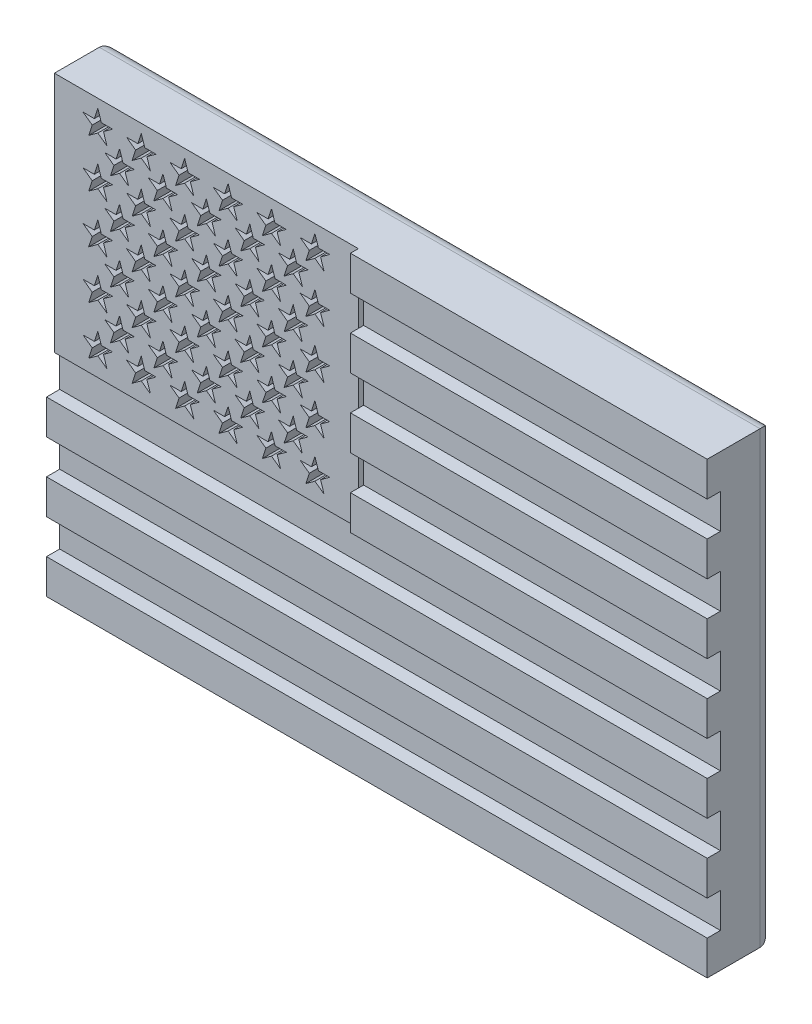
SolidWorks part; units mm, degrees
ref_plane "Front Plane" through (0, 0, 0) normal (0, 0, 1) x (1, 0, 0)
ref_plane "Top Plane" through (0, 0, 0) normal (0, 1, 0) x (1, 0, 0)
ref_plane "Right Plane" through (0, 0, 0) normal (1, 0, 0) x (0, 0, -1)
sketch "Sketch1" plane through (0, 0, 0) normal (0, 0, 1) x (1, 0, 0)
  line L1 (-15.875, -10.795) -> (15.875, -10.795)
  line L2 (-15.875, -10.795) -> (-15.875, 10.795)
  line L3 (-15.875, 10.795) -> (15.875, 10.795)
  line L4 (15.875, -10.795) -> (15.875, 10.795)
  line L5 (-15.875, -10.795) -> (15.875, 10.795) construction
  line L6 (-15.875, 10.795) -> (15.875, -10.795) construction
  point P0 (0, 0)
  dimension "D1" = 31.75
  dimension "D2" = 21.59
extrude "Boss-Extrude1" add sketch "Sketch1" along normal blind 2.54
fillet "Fillet1" radius 0.635 4 edges at (-15.875, 0, 0) (0, -10.795, 0) (0, 10.795, 0) (15.875, 0, 0)
sketch "Sketch2" plane through (0, 0, 2.54) normal (0, 0, 1) x (1, 0, 0)
  line L0 (15.875, 10.795) -> (15.875, 9.1342)
  line L1 (15.875, -10.795) -> (15.875, 10.795) construction
  line L2 (15.875, 9.1342) -> (15.875, 7.4735) construction
  line L3 (15.875, 7.4735) -> (15.875, 5.8127)
  line L4 (15.875, 5.8127) -> (15.875, 4.1519) construction
  line L5 (15.875, 4.1519) -> (15.875, 2.4912)
  line L6 (15.875, 2.4912) -> (15.875, 0.8304) construction
  line L7 (15.875, 0.8304) -> (15.875, -0.8304)
  line L10 (15.875, -0.8304) -> (15.875, -2.4912) construction
  line L11 (15.875, -2.4912) -> (15.875, -4.1519)
  line L12 (15.875, -4.1519) -> (15.875, -5.8127) construction
  line L13 (15.875, -5.8127) -> (15.875, -7.4735)
  line L14 (15.875, -7.4735) -> (15.875, -9.1342) construction
  line L15 (15.875, -9.1342) -> (15.875, -10.795)
  line L16 (-15.875, -10.795) -> (15.875, -10.795) construction
  line L17 (15.875, 4.1519) -> (-1.27, 4.1519)
  line L18 (15.875, 10.795) -> (-15.875, 10.795) construction
  line L19 (-1.27, 4.1519) -> (-1.27, 2.4912)
  line L21 (15.875, 9.1342) -> (-1.27, 9.1342)
  line L22 (-1.27, 10.795) -> (15.875, 10.795)
  line L23 (15.875, 7.4735) -> (-1.27, 7.4735)
  line L24 (15.875, 5.8127) -> (-1.27, 5.8127)
  line L25 (-1.27, 2.4912) -> (15.875, 2.4912)
  line L26 (-1.27, 5.8127) -> (-1.27, 7.4735)
  line L27 (-1.27, 9.1342) -> (-1.27, 10.795)
  line L28 (15.875, 0.8304) -> (-1.27, 0.8304)
  line L29 (-1.27, 0.8304) -> (-1.27, -0.8304)
  line L30 (-1.27, -0.8304) -> (15.875, -0.8304)
  line L31 (15.875, -2.4912) -> (-15.875, -2.4912)
  line L32 (-15.875, -2.4912) -> (-15.875, -4.1519)
  line L33 (-15.875, -4.1519) -> (15.875, -4.1519)
  line L34 (15.875, -5.8127) -> (-15.875, -5.8127)
  line L35 (-15.875, -5.8127) -> (-15.875, -7.4735)
  line L36 (-15.875, -7.4735) -> (15.875, -7.4735)
  line L37 (15.875, -9.1342) -> (-15.875, -9.1342)
  line L38 (-15.875, -9.1342) -> (-15.875, -10.795)
  line L39 (-15.875, -10.795) -> (15.875, -10.795)
  line L40 (-15.875, 10.795) -> (-15.875, -10.795) construction
  line L41 (-1.27, -0.8304) -> (-15.875, -0.8304) construction
  point P5 (-2.2743, -0.8304)
  point P43 (0, 0)
  dimension "D1" = 14.605
extrude "Boss-Extrude2" add sketch "Sketch2" along normal blind 0.635
sketch "Sketch3" plane through (0, 0, 2.54) normal (0, 0, 1) x (1, 0, 0)
  line L1 (-1.27, -0.8304) -> (-15.875, -0.8304)
  line L2 (-1.27, -0.8304) -> (-1.27, 10.795)
  line L3 (-1.27, 10.795) -> (-15.875, 10.795)
  line L4 (-15.875, -0.8304) -> (-15.875, 10.795)
extrude "Boss-Extrude3" add sketch "Sketch3" along normal blind 0.635
sketch "Sketch4" plane through (0, 0, 3.175) normal (0, 0, 1) x (1, 0, 0)
  line L0 (-15.875, 10.795) -> (-15.875, 8.4699) construction
  line L1 (-15.875, 10.795) -> (-15.875, -0.8304) construction
  line L2 (-15.875, 8.4699) -> (-15.875, 6.1448) construction
  line L3 (-15.875, 6.1448) -> (-15.875, 3.8198) construction
  line L4 (-15.875, 3.8198) -> (-15.875, 1.4947) construction
  line L5 (-15.875, 1.4947) -> (-15.875, -0.8304) construction
  line L6 (-15.875, 9.6325) -> (-13.7886, 9.6325) construction
  line L7 (-13.7886, 9.6325) -> (-11.7021, 9.6325) construction
  line L8 (-11.7021, 9.6325) -> (-9.6157, 9.6325) construction
  line L9 (-9.6157, 9.6325) -> (-7.5293, 9.6325) construction
  line L10 (-7.5293, 9.6325) -> (-5.4429, 9.6325) construction
  line L11 (-5.4429, 9.6325) -> (-3.3564, 9.6325) construction
  line L12 (-3.3564, 9.6325) -> (-1.27, 9.6325) construction
  line L13 (-13.7886, 10.3781) -> (-14.4977, 9.8629) construction
  line L14 (-14.4977, 9.8629) -> (-14.2269, 9.0292) construction
  line L15 (-14.2269, 9.0292) -> (-13.3503, 9.0292) construction
  line L16 (-13.3503, 9.0292) -> (-13.0794, 9.8629) construction
  line L17 (-13.0794, 9.8629) -> (-13.7886, 10.3781) construction
  line L18 (-13.7886, 10.3781) -> (-13.956, 9.8629)
  line L19 (-13.956, 9.8629) -> (-14.4977, 9.8629)
  line L20 (-14.4977, 9.8629) -> (-14.0594, 9.5444)
  line L21 (-14.0594, 9.5444) -> (-14.2269, 9.0292)
  line L22 (-14.2269, 9.0292) -> (-13.7886, 9.3476)
  line L23 (-13.7886, 9.3476) -> (-13.3503, 9.0292)
  line L24 (-13.3503, 9.0292) -> (-13.5177, 9.5444)
  line L25 (-13.5177, 9.5444) -> (-13.0794, 9.8629)
  line L26 (-13.0794, 9.8629) -> (-13.6212, 9.8629)
  line L27 (-13.6212, 9.8629) -> (-13.7886, 10.3781)
  line L28 (-14.0594, 9.5444) -> (-13.7886, 9.6325) construction
  line L29 (-13.7886, 9.6325) -> (-13.7886, 9.3476) construction
  line L30 (-13.5177, 9.5444) -> (-13.7886, 9.6325) construction
  line L31 (-13.7886, 9.6325) -> (-13.6212, 9.8629) construction
  line L32 (-13.956, 9.8629) -> (-13.7886, 9.6325) construction
  line L33 (-11.5347, 9.8629) -> (-11.7021, 10.3781)
  line L34 (-11.7021, 10.3781) -> (-11.8696, 9.8629)
  line L35 (-11.8696, 9.8629) -> (-12.4113, 9.8629)
  line L36 (-12.4113, 9.8629) -> (-11.973, 9.5444)
  line L37 (-11.973, 9.5444) -> (-12.1404, 9.0292)
  line L38 (-12.1404, 9.0292) -> (-11.7021, 9.3476)
  line L39 (-11.7021, 9.3476) -> (-11.2639, 9.0292)
  line L40 (-11.2639, 9.0292) -> (-11.4313, 9.5444)
  line L41 (-11.4313, 9.5444) -> (-10.993, 9.8629)
  line L42 (-10.993, 9.8629) -> (-11.5347, 9.8629)
  line L43 (-9.4483, 9.8629) -> (-9.6157, 10.3781)
  line L44 (-9.6157, 10.3781) -> (-9.7831, 9.8629)
  line L45 (-9.7831, 9.8629) -> (-10.3249, 9.8629)
  line L46 (-10.3249, 9.8629) -> (-9.8866, 9.5444)
  line L47 (-9.8866, 9.5444) -> (-10.054, 9.0292)
  line L48 (-10.054, 9.0292) -> (-9.6157, 9.3476)
  line L49 (-9.6157, 9.3476) -> (-9.1774, 9.0292)
  line L50 (-9.1774, 9.0292) -> (-9.3448, 9.5444)
  line L51 (-9.3448, 9.5444) -> (-8.9066, 9.8629)
  line L52 (-8.9066, 9.8629) -> (-9.4483, 9.8629)
  line L53 (-7.3619, 9.8629) -> (-7.5293, 10.3781)
  line L54 (-7.5293, 10.3781) -> (-7.6967, 9.8629)
  line L55 (-7.6967, 9.8629) -> (-8.2384, 9.8629)
  line L56 (-8.2384, 9.8629) -> (-7.8002, 9.5444)
  line L57 (-7.8002, 9.5444) -> (-7.9676, 9.0292)
  line L58 (-7.9676, 9.0292) -> (-7.5293, 9.3476)
  line L59 (-7.5293, 9.3476) -> (-7.091, 9.0292)
  line L60 (-7.091, 9.0292) -> (-7.2584, 9.5444)
  line L61 (-7.2584, 9.5444) -> (-6.8201, 9.8629)
  line L62 (-6.8201, 9.8629) -> (-7.3619, 9.8629)
  line L63 (-5.2754, 9.8629) -> (-5.4429, 10.3781)
  line L64 (-5.4429, 10.3781) -> (-5.6103, 9.8629)
  line L65 (-5.6103, 9.8629) -> (-6.152, 9.8629)
  line L66 (-6.152, 9.8629) -> (-5.7137, 9.5444)
  line L67 (-5.7137, 9.5444) -> (-5.8811, 9.0292)
  line L68 (-5.8811, 9.0292) -> (-5.4429, 9.3476)
  line L69 (-5.4429, 9.3476) -> (-5.0046, 9.0292)
  line L70 (-5.0046, 9.0292) -> (-5.172, 9.5444)
  line L71 (-5.172, 9.5444) -> (-4.7337, 9.8629)
  line L72 (-4.7337, 9.8629) -> (-5.2754, 9.8629)
  line L73 (-3.189, 9.8629) -> (-3.3564, 10.3781)
  line L74 (-3.3564, 10.3781) -> (-3.5238, 9.8629)
  line L75 (-3.5238, 9.8629) -> (-4.0656, 9.8629)
  line L76 (-4.0656, 9.8629) -> (-3.6273, 9.5444)
  line L77 (-3.6273, 9.5444) -> (-3.7947, 9.0292)
  line L78 (-3.7947, 9.0292) -> (-3.3564, 9.3476)
  line L79 (-3.3564, 9.3476) -> (-2.9181, 9.0292)
  line L80 (-2.9181, 9.0292) -> (-3.0856, 9.5444)
  line L81 (-3.0856, 9.5444) -> (-2.6473, 9.8629)
  line L82 (-2.6473, 9.8629) -> (-3.189, 9.8629)
  line L83 (-3.5238, 9.8629) -> (-3.189, 9.8629) construction
  line L84 (-15.875, 7.3074) -> (-13.7886, 7.3074) construction
  line L85 (-13.6212, 7.5446) -> (-13.7886, 8.0598)
  line L86 (-13.7886, 8.0598) -> (-13.956, 7.5446)
  line L87 (-13.956, 7.5446) -> (-14.4977, 7.5446)
  line L88 (-14.4977, 7.5446) -> (-14.0594, 7.2262)
  line L89 (-14.0594, 7.2262) -> (-14.2269, 6.7109)
  line L90 (-14.2269, 6.7109) -> (-13.7886, 7.0294)
  line L91 (-13.7886, 7.0294) -> (-13.3503, 6.7109)
  line L92 (-13.3503, 6.7109) -> (-13.5177, 7.2262)
  line L93 (-13.5177, 7.2262) -> (-13.0794, 7.5446)
  line L94 (-13.0794, 7.5446) -> (-13.6212, 7.5446)
  line L95 (-11.5347, 7.5446) -> (-11.7021, 8.0598)
  line L96 (-11.7021, 8.0598) -> (-11.8696, 7.5446)
  line L97 (-11.8696, 7.5446) -> (-12.4113, 7.5446)
  line L98 (-12.4113, 7.5446) -> (-11.973, 7.2262)
  line L99 (-11.973, 7.2262) -> (-12.1404, 6.7109)
  line L100 (-12.1404, 6.7109) -> (-11.7021, 7.0294)
  line L101 (-11.7021, 7.0294) -> (-11.2639, 6.7109)
  line L102 (-11.2639, 6.7109) -> (-11.4313, 7.2262)
  line L103 (-11.4313, 7.2262) -> (-10.993, 7.5446)
  line L104 (-10.993, 7.5446) -> (-11.5347, 7.5446)
  line L105 (-9.4483, 7.5446) -> (-9.6157, 8.0598)
  line L106 (-9.6157, 8.0598) -> (-9.7831, 7.5446)
  line L107 (-9.7831, 7.5446) -> (-10.3249, 7.5446)
  line L108 (-10.3249, 7.5446) -> (-9.8866, 7.2262)
  line L109 (-9.8866, 7.2262) -> (-10.054, 6.7109)
  line L110 (-10.054, 6.7109) -> (-9.6157, 7.0294)
  line L111 (-9.6157, 7.0294) -> (-9.1774, 6.7109)
  line L112 (-9.1774, 6.7109) -> (-9.3448, 7.2262)
  line L113 (-9.3448, 7.2262) -> (-8.9066, 7.5446)
  line L114 (-8.9066, 7.5446) -> (-9.4483, 7.5446)
  line L115 (-7.3619, 7.5446) -> (-7.5293, 8.0598)
  line L116 (-7.5293, 8.0598) -> (-7.6967, 7.5446)
  line L117 (-7.6967, 7.5446) -> (-8.2384, 7.5446)
  line L118 (-8.2384, 7.5446) -> (-7.8002, 7.2262)
  line L119 (-7.8002, 7.2262) -> (-7.9676, 6.7109)
  line L120 (-7.9676, 6.7109) -> (-7.5293, 7.0294)
  line L121 (-7.5293, 7.0294) -> (-7.091, 6.7109)
  line L122 (-7.091, 6.7109) -> (-7.2584, 7.2262)
  line L123 (-7.2584, 7.2262) -> (-6.8201, 7.5446)
  line L124 (-6.8201, 7.5446) -> (-7.3619, 7.5446)
  line L125 (-5.2754, 7.5446) -> (-5.4429, 8.0598)
  line L126 (-5.4429, 8.0598) -> (-5.6103, 7.5446)
  line L127 (-5.6103, 7.5446) -> (-6.152, 7.5446)
  line L128 (-6.152, 7.5446) -> (-5.7137, 7.2262)
  line L129 (-5.7137, 7.2262) -> (-5.8811, 6.7109)
  line L130 (-5.8811, 6.7109) -> (-5.4429, 7.0294)
  line L131 (-5.4429, 7.0294) -> (-5.0046, 6.7109)
  line L132 (-5.0046, 6.7109) -> (-5.172, 7.2262)
  line L133 (-5.172, 7.2262) -> (-4.7337, 7.5446)
  line L134 (-4.7337, 7.5446) -> (-5.2754, 7.5446)
  line L135 (-3.189, 7.5446) -> (-3.3564, 8.0598)
  line L136 (-3.3564, 8.0598) -> (-3.5238, 7.5446)
  line L137 (-3.5238, 7.5446) -> (-4.0656, 7.5446)
  line L138 (-4.0656, 7.5446) -> (-3.6273, 7.2262)
  line L139 (-3.6273, 7.2262) -> (-3.7947, 6.7109)
  line L140 (-3.7947, 6.7109) -> (-3.3564, 7.0294)
  line L141 (-3.3564, 7.0294) -> (-2.9181, 6.7109)
  line L142 (-2.9181, 6.7109) -> (-3.0856, 7.2262)
  line L143 (-3.0856, 7.2262) -> (-2.6473, 7.5446)
  line L144 (-2.6473, 7.5446) -> (-3.189, 7.5446)
  line L145 (-13.6212, 5.2263) -> (-13.7886, 5.7416)
  line L146 (-13.7886, 5.7416) -> (-13.956, 5.2263)
  line L147 (-13.956, 5.2263) -> (-14.4977, 5.2263)
  line L148 (-14.4977, 5.2263) -> (-14.0594, 4.9079)
  line L149 (-14.0594, 4.9079) -> (-14.2269, 4.3927)
  line L150 (-14.2269, 4.3927) -> (-13.7886, 4.7111)
  line L151 (-13.7886, 4.7111) -> (-13.3503, 4.3927)
  line L152 (-13.3503, 4.3927) -> (-13.5177, 4.9079)
  line L153 (-13.5177, 4.9079) -> (-13.0794, 5.2263)
  line L154 (-13.0794, 5.2263) -> (-13.6212, 5.2263)
  line L155 (-11.5347, 5.2263) -> (-11.7021, 5.7416)
  line L156 (-11.7021, 5.7416) -> (-11.8696, 5.2263)
  line L157 (-11.8696, 5.2263) -> (-12.4113, 5.2263)
  line L158 (-12.4113, 5.2263) -> (-11.973, 4.9079)
  line L159 (-11.973, 4.9079) -> (-12.1404, 4.3927)
  line L160 (-12.1404, 4.3927) -> (-11.7021, 4.7111)
  line L161 (-11.7021, 4.7111) -> (-11.2639, 4.3927)
  line L162 (-11.2639, 4.3927) -> (-11.4313, 4.9079)
  line L163 (-11.4313, 4.9079) -> (-10.993, 5.2263)
  line L164 (-10.993, 5.2263) -> (-11.5347, 5.2263)
  line L165 (-9.4483, 5.2263) -> (-9.6157, 5.7416)
  line L166 (-9.6157, 5.7416) -> (-9.7831, 5.2263)
  line L167 (-9.7831, 5.2263) -> (-10.3249, 5.2263)
  line L168 (-10.3249, 5.2263) -> (-9.8866, 4.9079)
  line L169 (-9.8866, 4.9079) -> (-10.054, 4.3927)
  line L170 (-10.054, 4.3927) -> (-9.6157, 4.7111)
  line L171 (-9.6157, 4.7111) -> (-9.1774, 4.3927)
  line L172 (-9.1774, 4.3927) -> (-9.3448, 4.9079)
  line L173 (-9.3448, 4.9079) -> (-8.9066, 5.2263)
  line L174 (-8.9066, 5.2263) -> (-9.4483, 5.2263)
  line L175 (-7.3619, 5.2263) -> (-7.5293, 5.7416)
  line L176 (-7.5293, 5.7416) -> (-7.6967, 5.2263)
  line L177 (-7.6967, 5.2263) -> (-8.2384, 5.2263)
  line L178 (-8.2384, 5.2263) -> (-7.8002, 4.9079)
  line L179 (-7.8002, 4.9079) -> (-7.9676, 4.3927)
  line L180 (-7.9676, 4.3927) -> (-7.5293, 4.7111)
  line L181 (-7.5293, 4.7111) -> (-7.091, 4.3927)
  line L182 (-7.091, 4.3927) -> (-7.2584, 4.9079)
  line L183 (-7.2584, 4.9079) -> (-6.8201, 5.2263)
  line L184 (-6.8201, 5.2263) -> (-7.3619, 5.2263)
  line L185 (-5.2754, 5.2263) -> (-5.4429, 5.7416)
  line L186 (-5.4429, 5.7416) -> (-5.6103, 5.2263)
  line L187 (-5.6103, 5.2263) -> (-6.152, 5.2263)
  line L188 (-6.152, 5.2263) -> (-5.7137, 4.9079)
  line L189 (-5.7137, 4.9079) -> (-5.8811, 4.3927)
  line L190 (-5.8811, 4.3927) -> (-5.4429, 4.7111)
  line L191 (-5.4429, 4.7111) -> (-5.0046, 4.3927)
  line L192 (-5.0046, 4.3927) -> (-5.172, 4.9079)
  line L193 (-5.172, 4.9079) -> (-4.7337, 5.2263)
  line L194 (-4.7337, 5.2263) -> (-5.2754, 5.2263)
  line L195 (-3.189, 5.2263) -> (-3.3564, 5.7416)
  line L196 (-3.3564, 5.7416) -> (-3.5238, 5.2263)
  line L197 (-3.5238, 5.2263) -> (-4.0656, 5.2263)
  line L198 (-4.0656, 5.2263) -> (-3.6273, 4.9079)
  line L199 (-3.6273, 4.9079) -> (-3.7947, 4.3927)
  line L200 (-3.7947, 4.3927) -> (-3.3564, 4.7111)
  line L201 (-3.3564, 4.7111) -> (-2.9181, 4.3927)
  line L202 (-2.9181, 4.3927) -> (-3.0856, 4.9079)
  line L203 (-3.0856, 4.9079) -> (-2.6473, 5.2263)
  line L204 (-2.6473, 5.2263) -> (-3.189, 5.2263)
  line L205 (-13.6212, 2.908) -> (-13.7886, 3.4233)
  line L206 (-13.7886, 3.4233) -> (-13.956, 2.908)
  line L207 (-13.956, 2.908) -> (-14.4977, 2.908)
  line L208 (-14.4977, 2.908) -> (-14.0594, 2.5896)
  line L209 (-14.0594, 2.5896) -> (-14.2269, 2.0744)
  line L210 (-14.2269, 2.0744) -> (-13.7886, 2.3928)
  line L211 (-13.7886, 2.3928) -> (-13.3503, 2.0744)
  line L212 (-13.3503, 2.0744) -> (-13.5177, 2.5896)
  line L213 (-13.5177, 2.5896) -> (-13.0794, 2.908)
  line L214 (-13.0794, 2.908) -> (-13.6212, 2.908)
  line L215 (-11.5347, 2.908) -> (-11.7021, 3.4233)
  line L216 (-11.7021, 3.4233) -> (-11.8696, 2.908)
  line L217 (-11.8696, 2.908) -> (-12.4113, 2.908)
  line L218 (-12.4113, 2.908) -> (-11.973, 2.5896)
  line L219 (-11.973, 2.5896) -> (-12.1404, 2.0744)
  line L220 (-12.1404, 2.0744) -> (-11.7021, 2.3928)
  line L221 (-11.7021, 2.3928) -> (-11.2639, 2.0744)
  line L222 (-11.2639, 2.0744) -> (-11.4313, 2.5896)
  line L223 (-11.4313, 2.5896) -> (-10.993, 2.908)
  line L224 (-10.993, 2.908) -> (-11.5347, 2.908)
  line L225 (-9.4483, 2.908) -> (-9.6157, 3.4233)
  line L226 (-9.6157, 3.4233) -> (-9.7831, 2.908)
  line L227 (-9.7831, 2.908) -> (-10.3249, 2.908)
  line L228 (-10.3249, 2.908) -> (-9.8866, 2.5896)
  line L229 (-9.8866, 2.5896) -> (-10.054, 2.0744)
  line L230 (-10.054, 2.0744) -> (-9.6157, 2.3928)
  line L231 (-9.6157, 2.3928) -> (-9.1774, 2.0744)
  line L232 (-9.1774, 2.0744) -> (-9.3448, 2.5896)
  line L233 (-9.3448, 2.5896) -> (-8.9066, 2.908)
  line L234 (-8.9066, 2.908) -> (-9.4483, 2.908)
  line L235 (-7.3619, 2.908) -> (-7.5293, 3.4233)
  line L236 (-7.5293, 3.4233) -> (-7.6967, 2.908)
  line L237 (-7.6967, 2.908) -> (-8.2384, 2.908)
  line L238 (-8.2384, 2.908) -> (-7.8002, 2.5896)
  line L239 (-7.8002, 2.5896) -> (-7.9676, 2.0744)
  line L240 (-7.9676, 2.0744) -> (-7.5293, 2.3928)
  line L241 (-7.5293, 2.3928) -> (-7.091, 2.0744)
  line L242 (-7.091, 2.0744) -> (-7.2584, 2.5896)
  line L243 (-7.2584, 2.5896) -> (-6.8201, 2.908)
  line L244 (-6.8201, 2.908) -> (-7.3619, 2.908)
  line L245 (-5.2754, 2.908) -> (-5.4429, 3.4233)
  line L246 (-5.4429, 3.4233) -> (-5.6103, 2.908)
  line L247 (-5.6103, 2.908) -> (-6.152, 2.908)
  line L248 (-6.152, 2.908) -> (-5.7137, 2.5896)
  line L249 (-5.7137, 2.5896) -> (-5.8811, 2.0744)
  line L250 (-5.8811, 2.0744) -> (-5.4429, 2.3928)
  line L251 (-5.4429, 2.3928) -> (-5.0046, 2.0744)
  line L252 (-5.0046, 2.0744) -> (-5.172, 2.5896)
  line L253 (-5.172, 2.5896) -> (-4.7337, 2.908)
  line L254 (-4.7337, 2.908) -> (-5.2754, 2.908)
  line L255 (-3.189, 2.908) -> (-3.3564, 3.4233)
  line L256 (-3.3564, 3.4233) -> (-3.5238, 2.908)
  line L257 (-3.5238, 2.908) -> (-4.0656, 2.908)
  line L258 (-4.0656, 2.908) -> (-3.6273, 2.5896)
  line L259 (-3.6273, 2.5896) -> (-3.7947, 2.0744)
  line L260 (-3.7947, 2.0744) -> (-3.3564, 2.3928)
  line L261 (-3.3564, 2.3928) -> (-2.9181, 2.0744)
  line L262 (-2.9181, 2.0744) -> (-3.0856, 2.5896)
  line L263 (-3.0856, 2.5896) -> (-2.6473, 2.908)
  line L264 (-2.6473, 2.908) -> (-3.189, 2.908)
  line L265 (-13.6212, 0.5898) -> (-13.7886, 1.105)
  line L266 (-13.7886, 1.105) -> (-13.956, 0.5898)
  line L267 (-13.956, 0.5898) -> (-14.4977, 0.5898)
  line L268 (-14.4977, 0.5898) -> (-14.0594, 0.2713)
  line L269 (-14.0594, 0.2713) -> (-14.2269, -0.2439)
  line L270 (-14.2269, -0.2439) -> (-13.7886, 0.0745)
  line L271 (-13.7886, 0.0745) -> (-13.3503, -0.2439)
  line L272 (-13.3503, -0.2439) -> (-13.5177, 0.2713)
  line L273 (-13.5177, 0.2713) -> (-13.0794, 0.5898)
  line L274 (-13.0794, 0.5898) -> (-13.6212, 0.5898)
  line L275 (-11.5347, 0.5898) -> (-11.7021, 1.105)
  line L276 (-11.7021, 1.105) -> (-11.8696, 0.5898)
  line L277 (-11.8696, 0.5898) -> (-12.4113, 0.5898)
  line L278 (-12.4113, 0.5898) -> (-11.973, 0.2713)
  line L279 (-11.973, 0.2713) -> (-12.1404, -0.2439)
  line L280 (-12.1404, -0.2439) -> (-11.7021, 0.0745)
  line L281 (-11.7021, 0.0745) -> (-11.2639, -0.2439)
  line L282 (-11.2639, -0.2439) -> (-11.4313, 0.2713)
  line L283 (-11.4313, 0.2713) -> (-10.993, 0.5898)
  line L284 (-10.993, 0.5898) -> (-11.5347, 0.5898)
  line L285 (-9.4483, 0.5898) -> (-9.6157, 1.105)
  line L286 (-9.6157, 1.105) -> (-9.7831, 0.5898)
  line L287 (-9.7831, 0.5898) -> (-10.3249, 0.5898)
  line L288 (-10.3249, 0.5898) -> (-9.8866, 0.2713)
  line L289 (-9.8866, 0.2713) -> (-10.054, -0.2439)
  line L290 (-10.054, -0.2439) -> (-9.6157, 0.0745)
  line L291 (-9.6157, 0.0745) -> (-9.1774, -0.2439)
  line L292 (-9.1774, -0.2439) -> (-9.3448, 0.2713)
  line L293 (-9.3448, 0.2713) -> (-8.9066, 0.5898)
  line L294 (-8.9066, 0.5898) -> (-9.4483, 0.5898)
  line L295 (-7.3619, 0.5898) -> (-7.5293, 1.105)
  line L296 (-7.5293, 1.105) -> (-7.6967, 0.5898)
  line L297 (-7.6967, 0.5898) -> (-8.2384, 0.5898)
  line L298 (-8.2384, 0.5898) -> (-7.8002, 0.2713)
  line L299 (-7.8002, 0.2713) -> (-7.9676, -0.2439)
  line L300 (-7.9676, -0.2439) -> (-7.5293, 0.0745)
  line L301 (-7.5293, 0.0745) -> (-7.091, -0.2439)
  line L302 (-7.091, -0.2439) -> (-7.2584, 0.2713)
  line L303 (-7.2584, 0.2713) -> (-6.8201, 0.5898)
  line L304 (-6.8201, 0.5898) -> (-7.3619, 0.5898)
  line L305 (-5.2754, 0.5898) -> (-5.4429, 1.105)
  line L306 (-5.4429, 1.105) -> (-5.6103, 0.5898)
  line L307 (-5.6103, 0.5898) -> (-6.152, 0.5898)
  line L308 (-6.152, 0.5898) -> (-5.7137, 0.2713)
  line L309 (-5.7137, 0.2713) -> (-5.8811, -0.2439)
  line L310 (-5.8811, -0.2439) -> (-5.4429, 0.0745)
  line L311 (-5.4429, 0.0745) -> (-5.0046, -0.2439)
  line L312 (-5.0046, -0.2439) -> (-5.172, 0.2713)
  line L313 (-5.172, 0.2713) -> (-4.7337, 0.5898)
  line L314 (-4.7337, 0.5898) -> (-5.2754, 0.5898)
  line L315 (-3.189, 0.5898) -> (-3.3564, 1.105)
  line L316 (-3.3564, 1.105) -> (-3.5238, 0.5898)
  line L317 (-3.5238, 0.5898) -> (-4.0656, 0.5898)
  line L318 (-4.0656, 0.5898) -> (-3.6273, 0.2713)
  line L319 (-3.6273, 0.2713) -> (-3.7947, -0.2439)
  line L320 (-3.7947, -0.2439) -> (-3.3564, 0.0745)
  line L321 (-3.3564, 0.0745) -> (-2.9181, -0.2439)
  line L322 (-2.9181, -0.2439) -> (-3.0856, 0.2713)
  line L323 (-3.0856, 0.2713) -> (-2.6473, 0.5898)
  line L324 (-2.6473, 0.5898) -> (-3.189, 0.5898)
  line L325 (-15.875, 0.3322) -> (-13.7886, 0.3322) construction
  line L326 (-13.7886, 0.0745) -> (-13.7886, 0.5898) construction
  circle A0 centre (-13.7886, 9.6325) radius 0.6032 construction
  point P31 (-3.3564, 9.8629)
  point P326 (-13.7886, 0.3322)
  point P339 (0, 0)
  point P341 (-12.7454, 8.4699)
  point P342 (-13.0162, 8.3819)
  dimension "D1" = 1.2065
  dimension "D2" = 72
  dimension "D3" = 72
  dimension "D4" = 72
  dimension "D5" = 72
  dimension "D6" = 6
  dimension "D7" = 5
extrude "Cut-Extrude1" cut sketch "Sketch4" against normal blind 1.905
sketch "Sketch5" plane through (0, 0, 3.175) normal (0, 0, 1) x (1, 0, 0)
  line L0 (-12.9128, 8.7037) -> (-13.4545, 8.7037)
  line L1 (-12.3071, 7.8701) -> (-12.4745, 8.3853)
  line L2 (-13.1836, 7.8701) -> (-12.7454, 8.1885)
  line L3 (-13.4545, 8.7037) -> (-13.0162, 8.3853)
  line L4 (-13.0162, 8.3853) -> (-13.1836, 7.8701)
  line L5 (-12.4745, 8.3853) -> (-12.0362, 8.7037)
  line L6 (-12.0362, 8.7037) -> (-12.5779, 8.7037)
  line L7 (-12.7454, 8.1885) -> (-12.3071, 7.8701)
  line L8 (-12.5779, 8.7037) -> (-12.7454, 9.219)
  line L9 (-12.7454, 9.219) -> (-12.9128, 8.7037)
  line L10 (-14.0594, 9.5444) -> (-13.0794, 9.8629) construction
  line L11 (-13.3503, 9.0292) -> (-13.956, 9.8629) construction
  line L12 (-14.2269, 9.0292) -> (-13.6212, 9.8629) construction
  line L13 (-13.7886, 10.3781) -> (-13.7886, 9.3476) construction
  line L14 (-13.5177, 9.5444) -> (-14.4977, 9.8629) construction
  line L15 (-13.7886, 8.0598) -> (-13.7886, 7.0294) construction
  line L16 (-14.2269, 6.7109) -> (-13.6212, 7.5446) construction
  line L17 (-14.4977, 7.5446) -> (-13.5177, 7.2262) construction
  line L18 (-13.0794, 7.5446) -> (-14.0594, 7.2262) construction
  line L19 (-13.3503, 6.7109) -> (-13.956, 7.5446) construction
  line L20 (-13.6212, 9.8629) -> (-13.7886, 10.3781)
  line L21 (-13.7886, 10.3781) -> (-13.956, 9.8629)
  line L22 (-13.956, 9.8629) -> (-14.4977, 9.8629)
  line L23 (-14.4977, 9.8629) -> (-14.0594, 9.5444)
  line L24 (-14.0594, 9.5444) -> (-14.2269, 9.0292)
  line L25 (-14.2269, 9.0292) -> (-13.7886, 9.3476)
  line L26 (-13.7886, 9.3476) -> (-13.3503, 9.0292)
  line L27 (-13.3503, 9.0292) -> (-13.5177, 9.5444)
  line L28 (-13.5177, 9.5444) -> (-13.0794, 9.8629)
  line L29 (-13.0794, 9.8629) -> (-13.6212, 9.8629)
  line L30 (-13.6212, 9.8629) -> (-13.7886, 10.3781) construction
  line L31 (-13.7886, 10.3781) -> (-13.956, 9.8629) construction
  line L32 (-13.956, 9.8629) -> (-14.4977, 9.8629) construction
  line L33 (-14.4977, 9.8629) -> (-14.0594, 9.5444) construction
  line L34 (-14.0594, 9.5444) -> (-14.2269, 9.0292) construction
  line L35 (-14.2269, 9.0292) -> (-13.7886, 9.3476) construction
  line L36 (-13.7886, 9.3476) -> (-13.3503, 9.0292) construction
  line L37 (-13.3503, 9.0292) -> (-13.5177, 9.5444) construction
  line L38 (-13.5177, 9.5444) -> (-13.0794, 9.8629) construction
  line L39 (-13.0794, 9.8629) -> (-13.6212, 9.8629) construction
  line L40 (-12.1404, 6.7109) -> (-11.5347, 7.5446) construction
  line L41 (-11.2639, 6.7109) -> (-11.8696, 7.5446) construction
  line L42 (-10.993, 7.5446) -> (-11.973, 7.2262) construction
  line L43 (-11.7021, 7.0294) -> (-11.7021, 8.0598) construction
  line L44 (-11.4313, 7.2262) -> (-12.4113, 7.5446) construction
  line L45 (-13.7886, 7.3142) -> (-11.7021, 7.3142) construction
  line L46 (-13.7886, 7.3142) -> (-13.7886, 9.6325) construction
  line L47 (-12.7454, 7.3142) -> (-12.7454, 8.4733) construction
  line L48 (-12.7454, 8.4733) -> (-13.7886, 8.4733) construction
  line L49 (-11.7021, 10.3781) -> (-11.8696, 9.8629)
  line L50 (-11.8696, 9.8629) -> (-12.4113, 9.8629)
  line L51 (-12.4113, 9.8629) -> (-11.973, 9.5444)
  line L52 (-11.973, 9.5444) -> (-12.1404, 9.0292)
  line L53 (-12.1404, 9.0292) -> (-11.7021, 9.3476)
  line L54 (-11.7021, 9.3476) -> (-11.2639, 9.0292)
  line L55 (-11.2639, 9.0292) -> (-11.4313, 9.5444)
  line L56 (-11.4313, 9.5444) -> (-10.993, 9.8629)
  line L57 (-10.993, 9.8629) -> (-11.5347, 9.8629)
  line L58 (-11.5347, 9.8629) -> (-11.7021, 10.3781)
  line L59 (-11.7021, 10.3781) -> (-11.8696, 9.8629) construction
  line L60 (-11.8696, 9.8629) -> (-12.4113, 9.8629) construction
  line L61 (-12.4113, 9.8629) -> (-11.973, 9.5444) construction
  line L62 (-11.973, 9.5444) -> (-12.1404, 9.0292) construction
  line L63 (-12.1404, 9.0292) -> (-11.7021, 9.3476) construction
  line L64 (-11.7021, 9.3476) -> (-11.2639, 9.0292) construction
  line L65 (-11.2639, 9.0292) -> (-11.4313, 9.5444) construction
  line L66 (-11.4313, 9.5444) -> (-10.993, 9.8629) construction
  line L67 (-10.993, 9.8629) -> (-11.5347, 9.8629) construction
  line L68 (-11.5347, 9.8629) -> (-11.7021, 10.3781) construction
  line L69 (-9.6157, 7.0294) -> (-9.6157, 8.0598) construction
  line L70 (-9.8866, 7.2262) -> (-8.9066, 7.5446) construction
  line L71 (-9.3448, 7.2262) -> (-10.3249, 7.5446) construction
  line L72 (-9.4483, 7.5446) -> (-10.054, 6.7109) construction
  line L73 (-9.1774, 6.7109) -> (-9.7831, 7.5446) construction
  line L74 (-9.6157, 7.3142) -> (-11.7021, 7.3142) construction
  line L75 (-10.6589, 7.3142) -> (-10.6589, 8.4733) construction
  line L76 (-13.1836, 7.8701) -> (-12.5779, 8.7037) construction
  line L77 (-12.3071, 7.8701) -> (-12.9128, 8.7037) construction
  line L78 (-13.4545, 8.7037) -> (-12.4745, 8.3853) construction
  line L79 (-12.0362, 8.7037) -> (-13.0162, 8.3853) construction
  line L80 (-12.7454, 9.219) -> (-12.7454, 8.1885) construction
  line L81 (-10.8263, 8.7037) -> (-11.3681, 8.7037)
  line L82 (-11.3681, 8.7037) -> (-10.9298, 8.3853)
  line L83 (-10.9298, 8.3853) -> (-11.0972, 7.8701)
  line L84 (-11.0972, 7.8701) -> (-10.6589, 8.1885)
  line L85 (-10.6589, 8.1885) -> (-10.2206, 7.8701)
  line L86 (-10.2206, 7.8701) -> (-10.3881, 8.3853)
  line L87 (-10.3881, 8.3853) -> (-9.9498, 8.7037)
  line L88 (-9.9498, 8.7037) -> (-10.4915, 8.7037)
  line L89 (-10.4915, 8.7037) -> (-10.6589, 9.219)
  line L90 (-10.6589, 9.219) -> (-10.8263, 8.7037)
  line L91 (-8.7399, 8.7037) -> (-9.2817, 8.7037)
  line L92 (-9.2817, 8.7037) -> (-8.8434, 8.3853)
  line L93 (-8.8434, 8.3853) -> (-9.0108, 7.8701)
  line L94 (-9.0108, 7.8701) -> (-8.5725, 8.1885)
  line L95 (-8.5725, 8.1885) -> (-8.1342, 7.8701)
  line L96 (-8.1342, 7.8701) -> (-8.3016, 8.3853)
  line L97 (-8.3016, 8.3853) -> (-7.8633, 8.7037)
  line L98 (-7.8633, 8.7037) -> (-8.4051, 8.7037)
  line L99 (-8.4051, 8.7037) -> (-8.5725, 9.219)
  line L100 (-8.5725, 9.219) -> (-8.7399, 8.7037)
  line L101 (-6.6535, 8.7037) -> (-7.1952, 8.7037)
  line L102 (-7.1952, 8.7037) -> (-6.7569, 8.3853)
  line L103 (-6.7569, 8.3853) -> (-6.9244, 7.8701)
  line L104 (-6.9244, 7.8701) -> (-6.4861, 8.1885)
  line L105 (-6.4861, 8.1885) -> (-6.0478, 7.8701)
  line L106 (-6.0478, 7.8701) -> (-6.2152, 8.3853)
  line L107 (-6.2152, 8.3853) -> (-5.7769, 8.7037)
  line L108 (-5.7769, 8.7037) -> (-6.3187, 8.7037)
  line L109 (-6.3187, 8.7037) -> (-6.4861, 9.219)
  line L110 (-6.4861, 9.219) -> (-6.6535, 8.7037)
  line L111 (-4.5671, 8.7037) -> (-5.1088, 8.7037)
  line L112 (-5.1088, 8.7037) -> (-4.6705, 8.3853)
  line L113 (-4.6705, 8.3853) -> (-4.8379, 7.8701)
  line L114 (-4.8379, 7.8701) -> (-4.3996, 8.1885)
  line L115 (-4.3996, 8.1885) -> (-3.9614, 7.8701)
  line L116 (-3.9614, 7.8701) -> (-4.1288, 8.3853)
  line L117 (-4.1288, 8.3853) -> (-3.6905, 8.7037)
  line L118 (-3.6905, 8.7037) -> (-4.2322, 8.7037)
  line L119 (-4.2322, 8.7037) -> (-4.3996, 9.219)
  line L120 (-4.3996, 9.219) -> (-4.5671, 8.7037)
  line L121 (-10.8263, 8.7037) -> (-10.4915, 8.7037) construction
  line L122 (-12.7454, 7.3142) -> (-12.7454, 6.155) construction
  line L123 (-12.9128, 6.3855) -> (-13.4545, 6.3855)
  line L124 (-13.4545, 6.3855) -> (-13.0162, 6.067)
  line L125 (-13.0162, 6.067) -> (-13.1836, 5.5518)
  line L126 (-13.1836, 5.5518) -> (-12.7454, 5.8702)
  line L127 (-12.7454, 5.8702) -> (-12.3071, 5.5518)
  line L128 (-12.3071, 5.5518) -> (-12.4745, 6.067)
  line L129 (-12.4745, 6.067) -> (-12.0362, 6.3855)
  line L130 (-12.0362, 6.3855) -> (-12.5779, 6.3855)
  line L131 (-12.5779, 6.3855) -> (-12.7454, 6.9007)
  line L132 (-12.7454, 6.9007) -> (-12.9128, 6.3855)
  line L133 (-10.8263, 6.3855) -> (-11.3681, 6.3855)
  line L134 (-11.3681, 6.3855) -> (-10.9298, 6.067)
  line L135 (-10.9298, 6.067) -> (-11.0972, 5.5518)
  line L136 (-11.0972, 5.5518) -> (-10.6589, 5.8702)
  line L137 (-10.6589, 5.8702) -> (-10.2206, 5.5518)
  line L138 (-10.2206, 5.5518) -> (-10.3881, 6.067)
  line L139 (-10.3881, 6.067) -> (-9.9498, 6.3855)
  line L140 (-9.9498, 6.3855) -> (-10.4915, 6.3855)
  line L141 (-10.4915, 6.3855) -> (-10.6589, 6.9007)
  line L142 (-10.6589, 6.9007) -> (-10.8263, 6.3855)
  line L143 (-8.7399, 6.3855) -> (-9.2817, 6.3855)
  line L144 (-9.2817, 6.3855) -> (-8.8434, 6.067)
  line L145 (-8.8434, 6.067) -> (-9.0108, 5.5518)
  line L146 (-9.0108, 5.5518) -> (-8.5725, 5.8702)
  line L147 (-8.5725, 5.8702) -> (-8.1342, 5.5518)
  line L148 (-8.1342, 5.5518) -> (-8.3016, 6.067)
  line L149 (-8.3016, 6.067) -> (-7.8633, 6.3855)
  line L150 (-7.8633, 6.3855) -> (-8.4051, 6.3855)
  line L151 (-8.4051, 6.3855) -> (-8.5725, 6.9007)
  line L152 (-8.5725, 6.9007) -> (-8.7399, 6.3855)
  line L153 (-6.6535, 6.3855) -> (-7.1952, 6.3855)
  line L154 (-7.1952, 6.3855) -> (-6.7569, 6.067)
  line L155 (-6.7569, 6.067) -> (-6.9244, 5.5518)
  line L156 (-6.9244, 5.5518) -> (-6.4861, 5.8702)
  line L157 (-6.4861, 5.8702) -> (-6.0478, 5.5518)
  line L158 (-6.0478, 5.5518) -> (-6.2152, 6.067)
  line L159 (-6.2152, 6.067) -> (-5.7769, 6.3855)
  line L160 (-5.7769, 6.3855) -> (-6.3187, 6.3855)
  line L161 (-6.3187, 6.3855) -> (-6.4861, 6.9007)
  line L162 (-6.4861, 6.9007) -> (-6.6535, 6.3855)
  line L163 (-4.5671, 6.3855) -> (-5.1088, 6.3855)
  line L164 (-5.1088, 6.3855) -> (-4.6705, 6.067)
  line L165 (-4.6705, 6.067) -> (-4.8379, 5.5518)
  line L166 (-4.8379, 5.5518) -> (-4.3996, 5.8702)
  line L167 (-4.3996, 5.8702) -> (-3.9614, 5.5518)
  line L168 (-3.9614, 5.5518) -> (-4.1288, 6.067)
  line L169 (-4.1288, 6.067) -> (-3.6905, 6.3855)
  line L170 (-3.6905, 6.3855) -> (-4.2322, 6.3855)
  line L171 (-4.2322, 6.3855) -> (-4.3996, 6.9007)
  line L172 (-4.3996, 6.9007) -> (-4.5671, 6.3855)
  line L173 (-12.9128, 4.0672) -> (-13.4545, 4.0672)
  line L174 (-13.4545, 4.0672) -> (-13.0162, 3.7488)
  line L175 (-13.0162, 3.7488) -> (-13.1836, 3.2335)
  line L176 (-13.1836, 3.2335) -> (-12.7454, 3.552)
  line L177 (-12.7454, 3.552) -> (-12.3071, 3.2335)
  line L178 (-12.3071, 3.2335) -> (-12.4745, 3.7488)
  line L179 (-12.4745, 3.7488) -> (-12.0362, 4.0672)
  line L180 (-12.0362, 4.0672) -> (-12.5779, 4.0672)
  line L181 (-12.5779, 4.0672) -> (-12.7454, 4.5824)
  line L182 (-12.7454, 4.5824) -> (-12.9128, 4.0672)
  line L183 (-10.8263, 4.0672) -> (-11.3681, 4.0672)
  line L184 (-11.3681, 4.0672) -> (-10.9298, 3.7488)
  line L185 (-10.9298, 3.7488) -> (-11.0972, 3.2335)
  line L186 (-11.0972, 3.2335) -> (-10.6589, 3.552)
  line L187 (-10.6589, 3.552) -> (-10.2206, 3.2335)
  line L188 (-10.2206, 3.2335) -> (-10.3881, 3.7488)
  line L189 (-10.3881, 3.7488) -> (-9.9498, 4.0672)
  line L190 (-9.9498, 4.0672) -> (-10.4915, 4.0672)
  line L191 (-10.4915, 4.0672) -> (-10.6589, 4.5824)
  line L192 (-10.6589, 4.5824) -> (-10.8263, 4.0672)
  line L193 (-8.7399, 4.0672) -> (-9.2817, 4.0672)
  line L194 (-9.2817, 4.0672) -> (-8.8434, 3.7488)
  line L195 (-8.8434, 3.7488) -> (-9.0108, 3.2335)
  line L196 (-9.0108, 3.2335) -> (-8.5725, 3.552)
  line L197 (-8.5725, 3.552) -> (-8.1342, 3.2335)
  line L198 (-8.1342, 3.2335) -> (-8.3016, 3.7488)
  line L199 (-8.3016, 3.7488) -> (-7.8633, 4.0672)
  line L200 (-7.8633, 4.0672) -> (-8.4051, 4.0672)
  line L201 (-8.4051, 4.0672) -> (-8.5725, 4.5824)
  line L202 (-8.5725, 4.5824) -> (-8.7399, 4.0672)
  line L203 (-6.6535, 4.0672) -> (-7.1952, 4.0672)
  line L204 (-7.1952, 4.0672) -> (-6.7569, 3.7488)
  line L205 (-6.7569, 3.7488) -> (-6.9244, 3.2335)
  line L206 (-6.9244, 3.2335) -> (-6.4861, 3.552)
  line L207 (-6.4861, 3.552) -> (-6.0478, 3.2335)
  line L208 (-6.0478, 3.2335) -> (-6.2152, 3.7488)
  line L209 (-6.2152, 3.7488) -> (-5.7769, 4.0672)
  line L210 (-5.7769, 4.0672) -> (-6.3187, 4.0672)
  line L211 (-6.3187, 4.0672) -> (-6.4861, 4.5824)
  line L212 (-6.4861, 4.5824) -> (-6.6535, 4.0672)
  line L213 (-4.5671, 4.0672) -> (-5.1088, 4.0672)
  line L214 (-5.1088, 4.0672) -> (-4.6705, 3.7488)
  line L215 (-4.6705, 3.7488) -> (-4.8379, 3.2335)
  line L216 (-4.8379, 3.2335) -> (-4.3996, 3.552)
  line L217 (-4.3996, 3.552) -> (-3.9614, 3.2335)
  line L218 (-3.9614, 3.2335) -> (-4.1288, 3.7488)
  line L219 (-4.1288, 3.7488) -> (-3.6905, 4.0672)
  line L220 (-3.6905, 4.0672) -> (-4.2322, 4.0672)
  line L221 (-4.2322, 4.0672) -> (-4.3996, 4.5824)
  line L222 (-4.3996, 4.5824) -> (-4.5671, 4.0672)
  line L223 (-12.9128, 1.7489) -> (-13.4545, 1.7489)
  line L224 (-13.4545, 1.7489) -> (-13.0162, 1.4305)
  line L225 (-13.0162, 1.4305) -> (-13.1836, 0.9152)
  line L226 (-13.1836, 0.9152) -> (-12.7454, 1.2337)
  line L227 (-12.7454, 1.2337) -> (-12.3071, 0.9152)
  line L228 (-12.3071, 0.9152) -> (-12.4745, 1.4305)
  line L229 (-12.4745, 1.4305) -> (-12.0362, 1.7489)
  line L230 (-12.0362, 1.7489) -> (-12.5779, 1.7489)
  line L231 (-12.5779, 1.7489) -> (-12.7454, 2.2641)
  line L232 (-12.7454, 2.2641) -> (-12.9128, 1.7489)
  line L233 (-10.8263, 1.7489) -> (-11.3681, 1.7489)
  line L234 (-11.3681, 1.7489) -> (-10.9298, 1.4305)
  line L235 (-10.9298, 1.4305) -> (-11.0972, 0.9152)
  line L236 (-11.0972, 0.9152) -> (-10.6589, 1.2337)
  line L237 (-10.6589, 1.2337) -> (-10.2206, 0.9152)
  line L238 (-10.2206, 0.9152) -> (-10.3881, 1.4305)
  line L239 (-10.3881, 1.4305) -> (-9.9498, 1.7489)
  line L240 (-9.9498, 1.7489) -> (-10.4915, 1.7489)
  line L241 (-10.4915, 1.7489) -> (-10.6589, 2.2641)
  line L242 (-10.6589, 2.2641) -> (-10.8263, 1.7489)
  line L243 (-8.7399, 1.7489) -> (-9.2817, 1.7489)
  line L244 (-9.2817, 1.7489) -> (-8.8434, 1.4305)
  line L245 (-8.8434, 1.4305) -> (-9.0108, 0.9152)
  line L246 (-9.0108, 0.9152) -> (-8.5725, 1.2337)
  line L247 (-8.5725, 1.2337) -> (-8.1342, 0.9152)
  line L248 (-8.1342, 0.9152) -> (-8.3016, 1.4305)
  line L249 (-8.3016, 1.4305) -> (-7.8633, 1.7489)
  line L250 (-7.8633, 1.7489) -> (-8.4051, 1.7489)
  line L251 (-8.4051, 1.7489) -> (-8.5725, 2.2641)
  line L252 (-8.5725, 2.2641) -> (-8.7399, 1.7489)
  line L253 (-6.6535, 1.7489) -> (-7.1952, 1.7489)
  line L254 (-7.1952, 1.7489) -> (-6.7569, 1.4305)
  line L255 (-6.7569, 1.4305) -> (-6.9244, 0.9152)
  line L256 (-6.9244, 0.9152) -> (-6.4861, 1.2337)
  line L257 (-6.4861, 1.2337) -> (-6.0478, 0.9152)
  line L258 (-6.0478, 0.9152) -> (-6.2152, 1.4305)
  line L259 (-6.2152, 1.4305) -> (-5.7769, 1.7489)
  line L260 (-5.7769, 1.7489) -> (-6.3187, 1.7489)
  line L261 (-6.3187, 1.7489) -> (-6.4861, 2.2641)
  line L262 (-6.4861, 2.2641) -> (-6.6535, 1.7489)
  line L263 (-4.5671, 1.7489) -> (-5.1088, 1.7489)
  line L264 (-5.1088, 1.7489) -> (-4.6705, 1.4305)
  line L265 (-4.6705, 1.4305) -> (-4.8379, 0.9152)
  line L266 (-4.8379, 0.9152) -> (-4.3996, 1.2337)
  line L267 (-4.3996, 1.2337) -> (-3.9614, 0.9152)
  line L268 (-3.9614, 0.9152) -> (-4.1288, 1.4305)
  line L269 (-4.1288, 1.4305) -> (-3.6905, 1.7489)
  line L270 (-3.6905, 1.7489) -> (-4.2322, 1.7489)
  line L271 (-4.2322, 1.7489) -> (-4.3996, 2.2641)
  line L272 (-4.3996, 2.2641) -> (-4.5671, 1.7489)
  line L273 (-13.1836, 5.5518) -> (-12.5779, 6.3855) construction
  line L274 (-12.3071, 5.5518) -> (-12.9128, 6.3855) construction
  point P2 (-13.7886, 9.6325)
  point P21 (-13.7886, 7.3142)
  point P52 (-11.7021, 7.3142)
  point P99 (-9.6157, 7.3142)
  point P103 (-10.6589, 8.7037)
  point P104 (-12.7454, 8.4733)
  point P110 (-12.7454, 6.155)
  point P147 (-12.7454, 6.0976)
  point P298 (-12.7454, 6.155)
  dimension "D3" = 1.0305
  dimension "D4" = 0.5418
  dimension "D5" = 36
  dimension "D1" = 0
  dimension "D2" = 0
  dimension "D6" = 5
  dimension "D7" = 4
extrude "Cut-Extrude2" cut sketch "Sketch5" against normal blind 1.905
sketch "Sketch6" plane through (0, 0, 3.175) normal (0, 0, 1) x (1, 0, 0)
  line L0 (-15.875, -0.8304) -> (15.875, -0.8304) construction
  line L1 (-1.27, -0.8304) -> (-15.875, -0.8304)
  line L2 (-1.27, -0.8304) -> (-1.27, 10.795)
  line L3 (-1.27, 10.795) -> (-15.875, 10.795)
  line L4 (-15.875, -0.8304) -> (-15.875, 10.795)
  point P7 (0, 0)
extrude "Cut-Extrude3" cut sketch "Sketch6" against normal blind 0.381
